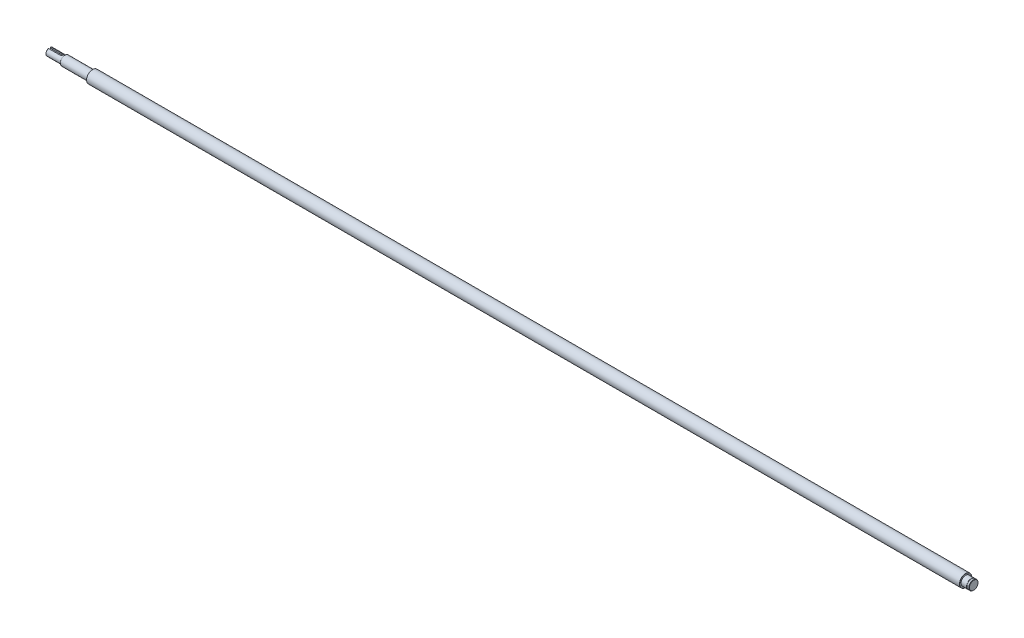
SolidWorks part; units mm, degrees
ref_plane "Front Plane" through (0, 0, 0) normal (0, 0, 1) x (1, 0, 0)
ref_plane "Top Plane" through (0, 0, 0) normal (0, 1, 0) x (1, 0, 0)
ref_plane "Right Plane" through (0, 0, 0) normal (1, 0, 0) x (0, 0, -1)
sketch "Sketch1" plane through (0, 0, 0) normal (0, 0, 1) x (1, 0, 0)
  line L0 (0, 0) -> (1500, 0)
  line L1 (0, 0) -> (0, 6)
  line L2 (0, 6) -> (25, 6)
  line L3 (25, 6) -> (25, 7.5)
  line L4 (25, 7.5) -> (70, 7.5)
  line L5 (70, 7.5) -> (70, 9.9)
  line L6 (70, 9.9) -> (1487, 9.9)
  line L7 (1487, 9.9) -> (1487, 7.5)
  line L9 (1500, 7.5) -> (1500, 0)
  line L10 (1500, 7.5) -> (1497.15, 7.5)
  line L11 (1497.15, 7.5) -> (1497.15, 7.15)
  line L12 (1497.15, 7.15) -> (1496, 7.15)
  line L13 (1496, 7.15) -> (1496, 7.5)
  line L14 (1496, 7.5) -> (1487, 7.5)
  dimension "D1" = 6
  dimension "D2" = 25
  dimension "D3" = 45
  dimension "D4" = 13
  dimension "D5" = 1500
  dimension "D6" = 7.5
  dimension "D7" = 9.9
  dimension "D8" = 2.85
  dimension "D9" = 0.35
  dimension "D10" = 1.15
  dimension "D11" = 7.5
revolve "Revolve1" add sketch "Sketch1" angle 360 about L0
chamfer "Chamfer1" distance 0.5 angle 45 2 edges at (1500, 0, 7.5) (0, 0, 6)
chamfer "Chamfer2" distance 0.2 angle 45 3 edges at (70, 0, 9.9) (25, 0, 7.5) (1487, 0, 9.9)
ref_plane "Plane2" through (0, 3.5, 0) normal (0, 1, 0) x (1, 0, 0)
sketch "Sketch4" plane through (0, 3.5, 0) normal (0, 1, 0) x (1, 0, 0)
  line L0 (0, -2) -> (0, 2)
  line L1 (0, 2) -> (20, 2)
  line L3 (0, -2) -> (20, -2)
  arc A0 (20, -2) -> (20, 2) centre (20, 0) ccw
  point P0 (0, 0)
  dimension "D1" = 4
extrude "Cut-Extrude1" cut sketch "Sketch4" along normal blind 4
